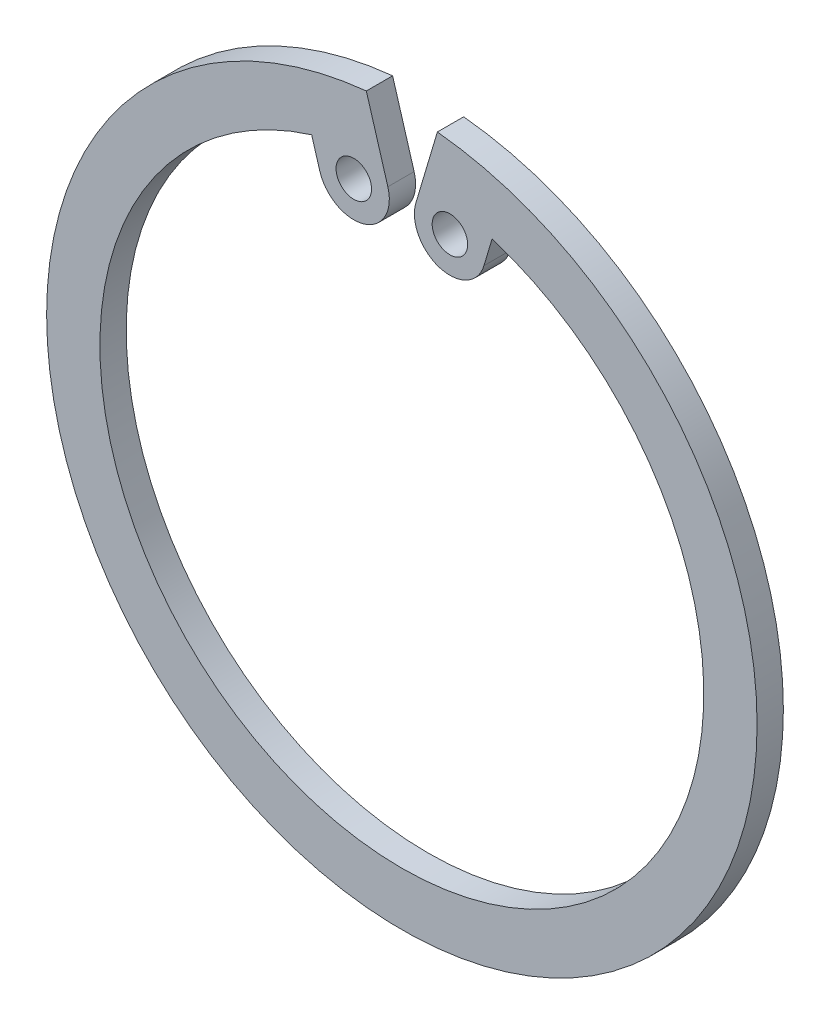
SolidWorks part; units mm, degrees
ref_plane "Plane1" through (0, 0, 0) normal (0, 0, 1) x (1, 0, 0)
ref_plane "Plane2" through (0, 0, 0) normal (0, 1, 0) x (1, 0, 0)
ref_plane "Plane3" through (0, 0, 0) normal (1, 0, 0) x (0, 0, -1)
sketch "Sketch1" plane through (0, 0, 0) normal (0, 0, 1) x (1, 0, 0)
  line L0 (0.789, 15.8328) -> (2, 19.8997)
  line L1 (-5.0789, 16.2236) -> (-4.6226, 14.6912)
  line L2 (5.0789, 16.2236) -> (4.6226, 14.6912)
  line L3 (0, 0) -> (0, 66.3581) construction
  line L4 (-0.789, 15.8328) -> (-2, 19.8997)
  arc A0 (-2, 19.8997) -> (2, 19.8997) centre (0, 0) ccw
  arc A1 (-5.0789, 16.2236) -> (5.0789, 16.2236) centre (0, 0) ccw
  arc A2 (-4.6226, 14.6912) -> (-0.789, 15.8328) centre (-2.7058, 15.262) ccw
  arc A3 (4.6226, 14.6912) -> (0.789, 15.8328) centre (2.7058, 15.262) cw
  circle A4 centre (2.7058, 15.262) radius 1
  circle A5 centre (-2.7058, 15.262) radius 1
  dimension "D1" = 20
  dimension "D2" = 17
  dimension "D4" = 1.5
  dimension "D3" = 2
  dimension "D6" = 2
  dimension "D5" = 33.164
  dimension "D7" = 4
extrude "Base-Extrude" add sketch "Sketch1" along normal blind 1.48
